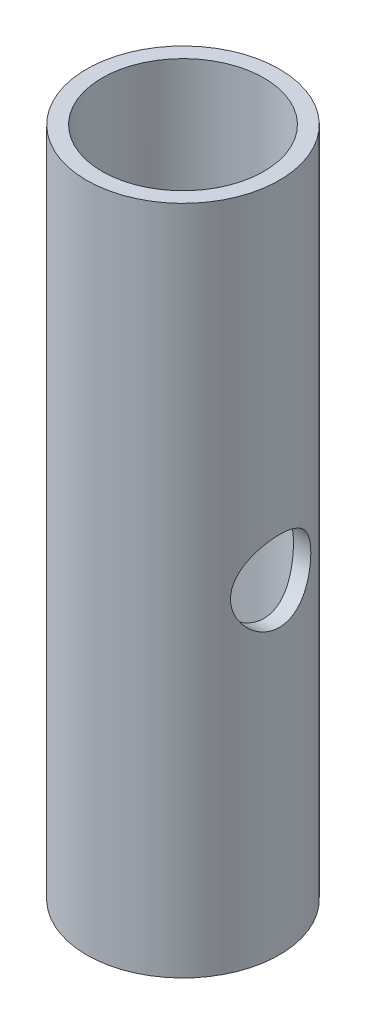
SolidWorks part; units mm, degrees
ref_plane "Front Plane" through (0, 0, 0) normal (0, 0, 1) x (1, 0, 0)
ref_plane "Top Plane" through (0, 0, 0) normal (0, 1, 0) x (1, 0, 0)
ref_plane "Right Plane" through (0, 0, 0) normal (1, 0, 0) x (0, 0, -1)
sketch "Sketch1" plane through (0, 0, 0) normal (0, 1, 0) x (1, 0, 0)
  circle A0 centre (0, 0) radius 2.3813
  circle A1 centre (0, 0) radius 2
  dimension "D1" = 4.7625
  dimension "D2" = 4
extrude "Boss-Extrude1" add sketch "Sketch1" along normal blind 16.5735
sketch "Sketch2" plane through (0, 0, 0) normal (1, 0, 0) x (0, 0, -1)
  line L0 (-2.3813, 8.001) -> (2.3813, 8.001) construction
  line L1 (-2.3813, 16.5735) -> (-2.3813, 0) construction
  line L2 (2.3813, 0) -> (2.3813, 16.5735) construction
  line L4 (2.3813, 16.5735) -> (-2.3813, 16.5735) construction
  circle A0 centre (0, 8.001) radius 0.9922
  point P6 (0, 8.001)
  dimension "D1" = 1.9844
  dimension "D2" = 8.5725
extrude "Cut-Extrude1" cut sketch "Sketch2" against normal through all both and the other way through all
